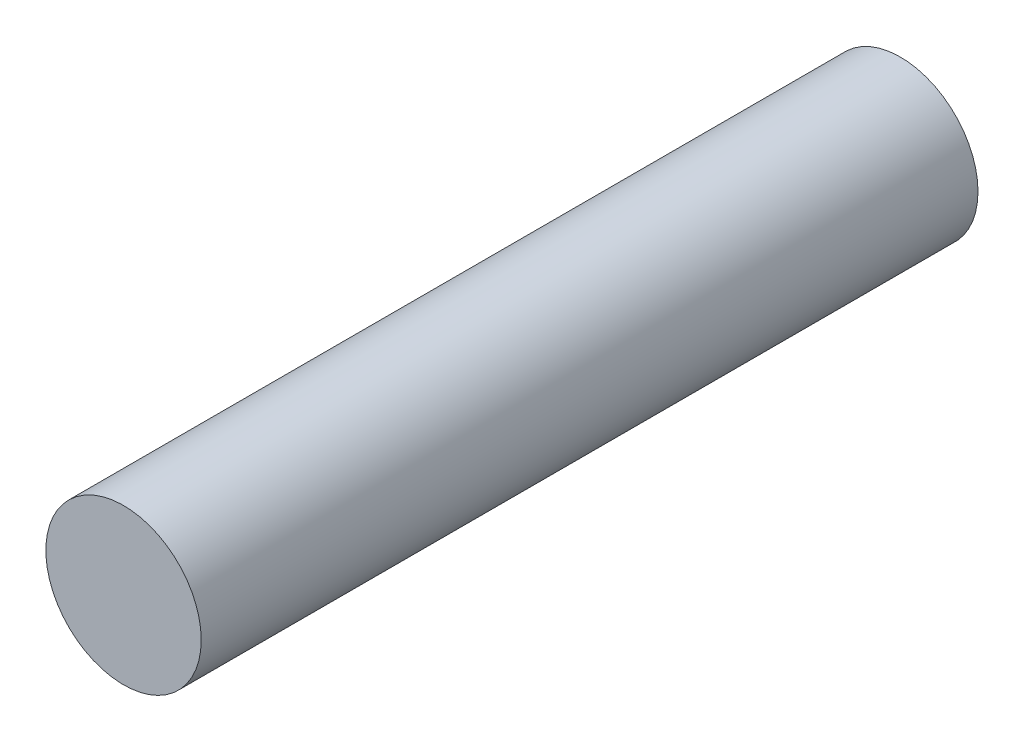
SolidWorks part; units mm, degrees
ref_plane "Front" through (0, 0, 0) normal (0, 0, 1) x (1, 0, 0)
ref_plane "Top" through (0, 0, 0) normal (0, 1, 0) x (1, 0, 0)
ref_plane "Right" through (0, 0, 0) normal (1, 0, 0) x (0, 0, -1)
sketch "Sketch1" plane through (0, 0, 0) normal (0, 0, 1) x (1, 0, 0)
  circle A0 centre (0, 0) radius 1.27
  dimension "D1" = 2.54
extrude "Base-Extrude" add sketch "Sketch1" along normal blind 12.7
